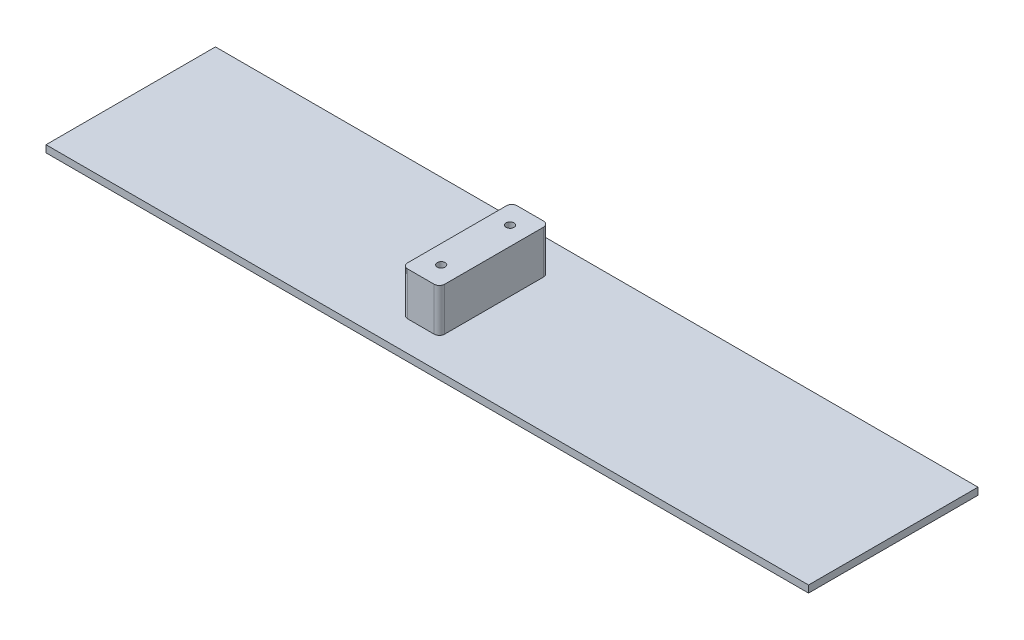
SolidWorks part; units mm, degrees
ref_plane "Front Plane" through (0, 0, 0) normal (0, 0, 1) x (1, 0, 0)
ref_plane "Top Plane" through (0, 0, 0) normal (0, 1, 0) x (1, 0, 0)
ref_plane "Right Plane" through (0, 0, 0) normal (1, 0, 0) x (0, 0, -1)
sketch "Sketch1" plane through (0, 0, 0) normal (0, 1, 0) x (1, 0, 0)
  line L0 (-685.8, -152.4) -> (685.8, 152.4) construction
  line L1 (-685.8, 152.4) -> (685.8, 152.4)
  line L2 (-685.8, 152.4) -> (-685.8, -152.4)
  line L3 (-685.8, -152.4) -> (685.8, -152.4)
  line L4 (685.8, 152.4) -> (685.8, -152.4)
  dimension "D1" = 1371.6
  dimension "D2" = 304.8
extrude "Extrude1" add sketch "Sketch1" against normal blind 12.7
sketch "Sketch2" plane through (-68.0212, 0, 0) normal (0, 1, 0) x (-1, 0, 0)
  line L32 (-35.8733, 88.9) -> (-35.8733, -88.9)
  line L33 (21.2767, 98.425) -> (-26.3483, 98.425)
  line L34 (30.8017, -88.9) -> (30.8017, 88.9)
  line L35 (-26.3483, -98.425) -> (21.2767, -98.425)
  line L36 (-35.8733, 88.9) -> (-35.8733, -88.9)
  line L37 (21.2767, 98.425) -> (-26.3483, 98.425)
  line L38 (30.8017, -88.9) -> (30.8017, 88.9)
  line L39 (-26.3483, -98.425) -> (21.2767, -98.425)
  circle A0 centre (-2.5358, 61.9125) radius 7.1438
  circle A1 centre (-2.5358, -61.9125) radius 7.1438
  arc A2 (4.608, -61.9125) -> (-9.6795, -61.9125) centre (-2.5358, -61.9125) ccw construction
  arc A3 (-9.6795, 61.9125) -> (4.608, 61.9125) centre (-2.5358, 61.9125) ccw construction
  arc A36 (-26.3483, 98.425) -> (-35.8733, 88.9) centre (-26.3483, 88.9) ccw
  arc A37 (30.8017, 88.9) -> (21.2767, 98.425) centre (21.2767, 88.9) ccw
  arc A38 (21.2767, -98.425) -> (30.8017, -88.9) centre (21.2767, -88.9) ccw
  arc A39 (-35.8733, -88.9) -> (-26.3483, -98.425) centre (-26.3483, -88.9) ccw
  arc A40 (-26.3483, 98.425) -> (-35.8733, 88.9) centre (-26.3483, 88.9) ccw
  arc A41 (30.8017, 88.9) -> (21.2767, 98.425) centre (21.2767, 88.9) ccw
  arc A42 (21.2767, -98.425) -> (30.8017, -88.9) centre (21.2767, -88.9) ccw
  arc A43 (-35.8733, -88.9) -> (-26.3483, -98.425) centre (-26.3483, -88.9) ccw
  dimension "D1" = 6.35
extrude "Extrude2" add sketch "Sketch2" along normal up to surface (77.7875 mm away)
other "Smart-Feature1<bearing-1>"
